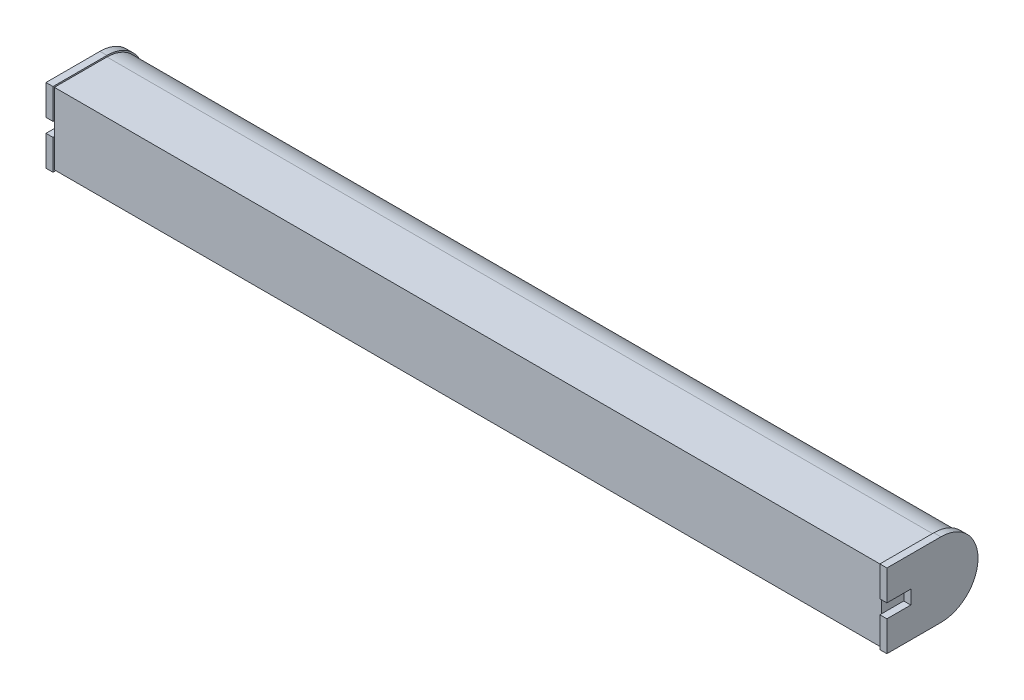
SolidWorks part; units mm, degrees
ref_plane "Alzado" through (0, 0, 0) normal (0, 0, 1) x (1, 0, 0)
ref_plane "Planta" through (0, 0, 0) normal (0, 1, 0) x (1, 0, 0)
ref_plane "Vista lateral" through (0, 0, 0) normal (1, 0, 0) x (0, 0, -1)
sketch "Croquis1" plane through (0, 0, 0) normal (1, 0, 0) x (0, 0, -1)
  line L0 (-25.7319, 4.9197) -> (-25.7319, 26.5)
  line L1 (-25.7319, -26.5) -> (12.7681, -26.5)
  line L2 (-25.7319, -26.5) -> (-25.7319, -4.9197)
  line L3 (-25.7319, 26.5) -> (12.7681, 26.5)
  line L5 (-25.7319, -4.9197) -> (-8.6989, -4.9197)
  line L7 (-25.7319, 4.9197) -> (-8.6989, 4.9197)
  line L8 (-8.6989, -4.9197) -> (-8.6989, 4.9197)
  arc A1 (12.7681, -26.5) -> (12.7681, 26.5) centre (12.7681, 0) ccw
  point P0 (0, 0)
  point P6 (-25.7319, 0)
  dimension "D1" = 53
  dimension "D2" = 26.5
  dimension "D3" = 38.5
extrude "Saliente-Extruir1" add sketch "Croquis1" along normal blind 5
sketch "Croquis2" plane through (5, 0, 0) normal (1, 0, 0) x (0, 0, -1)
  line L7 (-24.7319, 5.9197) -> (-24.7319, -5.9197)
  line L14 (12.7681, 25.5) -> (-24.7319, 25.5)
  line L15 (-24.7319, 25.5) -> (-24.7319, 5.9197)
  line L16 (-24.7319, 5.9197) -> (-7.6989, 5.9197)
  line L17 (-7.6989, 5.9197) -> (-7.6989, -5.9197)
  line L18 (-7.6989, -5.9197) -> (-24.7319, -5.9197)
  line L19 (-24.7319, -5.9197) -> (-24.7319, -25.5)
  line L20 (-24.7319, -25.5) -> (12.7681, -25.5)
  line L21 (12.7681, 25.5) -> (-24.7319, 25.5)
  line L22 (-24.7319, 25.5) -> (-24.7319, 5.9197)
  line L26 (-24.7319, -5.9197) -> (-24.7319, -25.5)
  line L27 (-24.7319, -25.5) -> (12.7681, -25.5)
  arc A2 (12.7681, -25.5) -> (12.7681, 25.5) centre (12.7681, 0) ccw
  arc A3 (12.7681, -25.5) -> (12.7681, 25.5) centre (12.7681, 0) ccw
  dimension "D1" = 1
extrude "Saliente-Extruir2" add sketch "Croquis2" along normal blind 590
ref_plane "Plano1" through (300, 0, 0) normal (1, 0, 0) x (0, 0, -1)
mirror "Simetría1" about plane through (300, 0, 0) normal (1, 0, 0) of "Saliente-Extruir1"
